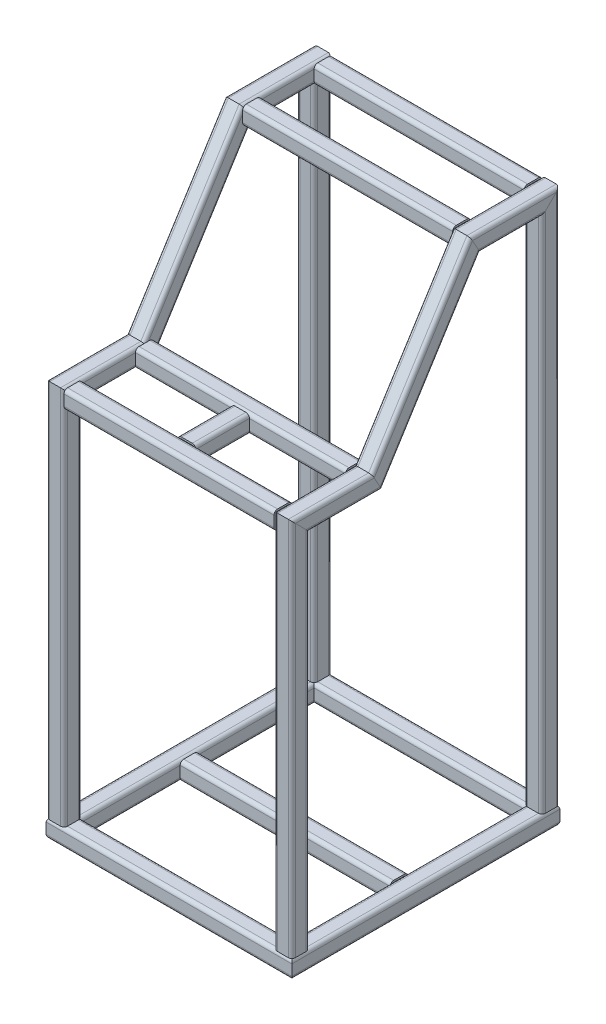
SolidWorks part; units mm, degrees
ref_plane "Płaszczyzna przednia" through (0, 0, 0) normal (0, 0, 1) x (1, 0, 0)
ref_plane "Płaszczyzna górna" through (0, 0, 0) normal (0, 1, 0) x (1, 0, 0)
ref_plane "Płaszczyzna prawa" through (0, 0, 0) normal (1, 0, 0) x (0, 0, -1)
sketch3d "Szkic 3D1"
  line L0 (-275, -1200, 0) -> (-275, 0, 0)
  line L1 (-275, 0, 0) -> (275, 0, 0)
  line L2 (275, 0, 0) -> (275, -1200, 0)
  line L3 (-275, 0, 0) -> (-275, 0, 200)
  line L4 (-275, 0, 200) -> (-275, -350, 420)
  line L5 (-275, -350, 420) -> (-275, -350, 600)
  line L6 (-275, -350, 600) -> (-275, -1200, 600)
  line L7 (275, 0, 0) -> (275, 0, 200)
  line L8 (275, 0, 200) -> (275, -350, 420)
  line L9 (275, -350, 420) -> (275, -350, 600)
  line L10 (275, -350, 600) -> (275, -1200, 600)
  line L11 (-275, -350, 600) -> (275, -350, 600)
  line L12 (-275, -350, 420) -> (275, -350, 420)
  line L13 (-275, 0, 200) -> (275, 0, 200)
  line L14 (-275, -1200, 0) -> (-275, -1200, 600)
  line L15 (-275, -1200, 600) -> (275, -1200, 600)
  line L16 (275, -1200, 600) -> (275, -1200, 0)
  line L17 (275, -1200, 0) -> (-275, -1200, 0)
  line L18 (-275, -1200, 340) -> (275, -1200, 340)
  line L19 (0, -350, 600) -> (0, -350, 420)
  dimension "D1" = 1200
  dimension "D2" = 850
  dimension "D3" = 180
  dimension "D4" = 200
  dimension "D5" = 600
  dimension "D6" = 550
  dimension "D7" = 260
other "Rura kwadratowa 40 X 40 X 4(1)"
ref_plane "Płaszczyzna1" through (-275, -1220, 580) normal (1, 0, 0) x (0, 0, -1)
sketch "Sketch1" plane through (-275, -1220, 580) normal (1, 0, 0) x (0, 0, -1)
  line L0 (-12, -16) -> (12, -16)
  line L1 (-16, -12) -> (-16, 12)
  line L2 (12, 16) -> (-12, 16)
  line L3 (16, 12) -> (16, -12)
  line L4 (-12, -20) -> (12, -20)
  line L5 (-20, -12) -> (-20, 12)
  line L6 (12, 20) -> (-12, 20)
  line L7 (20, 12) -> (20, -12)
  arc A0 (20, 12) -> (12, 20) centre (12, 12) ccw
  arc A1 (12, -20) -> (20, -12) centre (12, -12) ccw
  arc A2 (-20, -12) -> (-12, -20) centre (-12, -12) ccw
  arc A3 (-12, 20) -> (-20, 12) centre (-12, 12) ccw
  arc A4 (-12, 16) -> (-16, 12) centre (-12, 12) ccw
  arc A5 (16, 12) -> (12, 16) centre (12, 12) ccw
  arc A6 (12, -16) -> (16, -12) centre (12, -12) ccw
  arc A7 (-16, -12) -> (-12, -16) centre (-12, -12) ccw
  point P0 (-20, 0)
  point P1 (20, 0)
  point P2 (0, 20)
  point P3 (0, -20)
  point P4 (0, 0)
  point P5 (-20, -20)
  point P6 (20, -20)
  point P7 (20, 20)
  point P8 (-20, 20)
  point P33 (0, 0)
  dimension "D1" = 8
  dimension "Thickness" = 4
  dimension "V_leg" = 40
other "Przytnij/Wydłuż1"
